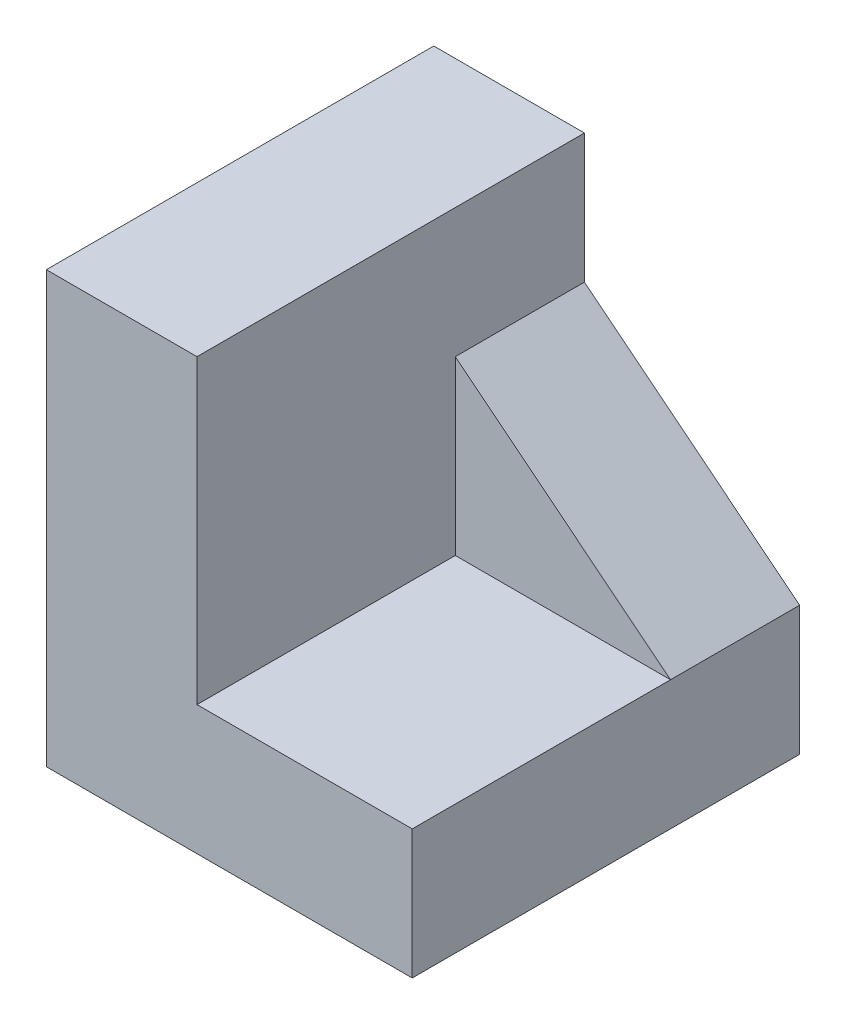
SolidWorks part; units mm, degrees
ref_plane "前视基准面" through (0, 0, 0) normal (0, 0, 1) x (1, 0, 0)
ref_plane "上视基准面" through (0, 0, 0) normal (0, 1, 0) x (1, 0, 0)
ref_plane "右视基准面" through (0, 0, 0) normal (1, 0, 0) x (0, 0, -1)
sketch "草图1" plane through (0, 0, 0) normal (0, 0, 1) x (1, 0, 0)
  line L0 (0, 0) -> (0, 40)
  line L1 (0, 40) -> (14, 40)
  line L2 (14, 40) -> (14, 12)
  line L3 (14, 12) -> (34, 12)
  line L4 (34, 12) -> (34, 0)
  line L5 (34, 0) -> (0, 0)
  dimension "D1" = 12
  dimension "D2" = 14
  dimension "D3" = 40
  dimension "D4" = 34
extrude "凸台-拉伸1" add sketch "草图1" along normal blind 36
sketch "草图3" plane through (0, 0, 0) normal (0, 0, -1) x (-1, 0, 0)
  line L0 (-14, 28) -> (-34, 12)
  line L1 (-14, 12) -> (-14, 40) construction
  line L2 (-34, 12) -> (-14, 12)
  line L3 (-14, 12) -> (-14, 28)
  dimension "D1" = 16
extrude "凸台-拉伸2" add sketch "草图3" against normal blind 12
